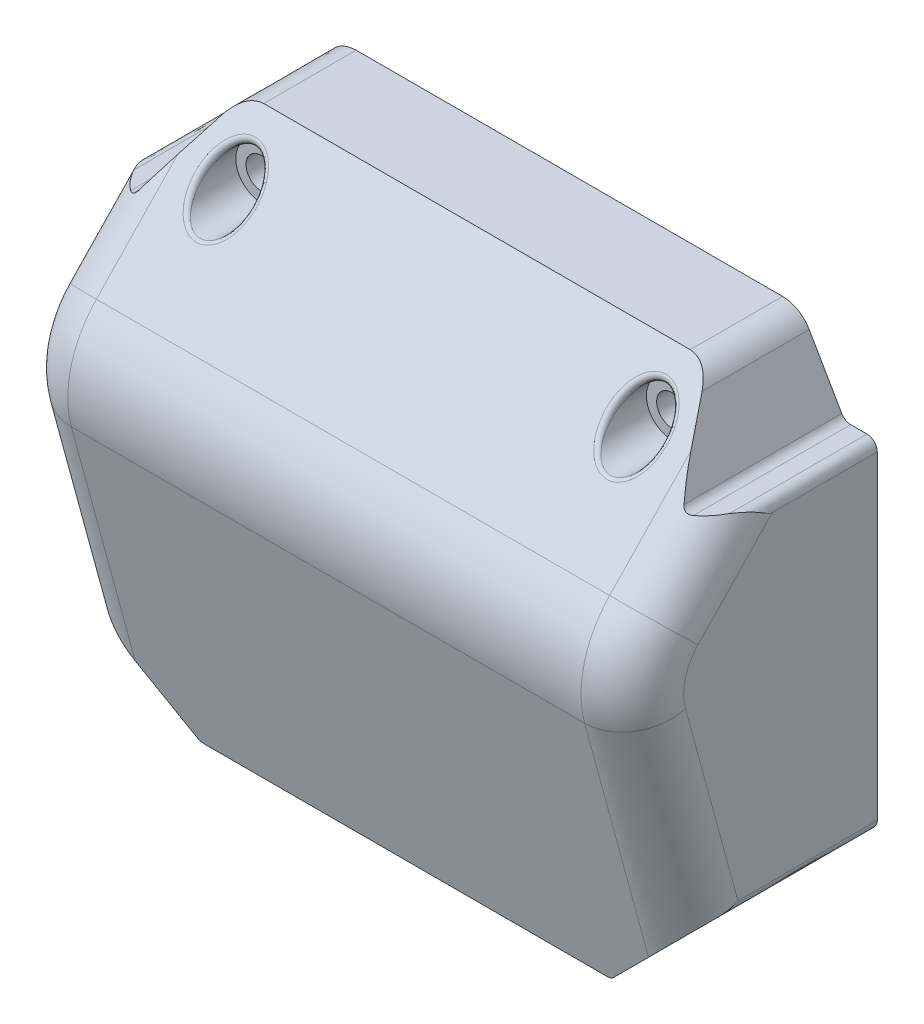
SolidWorks part; units mm, degrees
ref_plane "Płaszczyzna przednia" through (0, 0, 0) normal (0, 0, 1) x (1, 0, 0)
ref_plane "Płaszczyzna górna" through (0, 0, 0) normal (0, 1, 0) x (1, 0, 0)
ref_plane "Płaszczyzna prawa" through (0, 0, 0) normal (1, 0, 0) x (0, 0, -1)
sketch "Szkic1" plane through (0, 0, 0) normal (0, 0, 1) x (1, 0, 0)
  line L0 (-120, 129.8332) -> (-120, 67.6616)
  line L1 (-118, 131.8332) -> (-114.815, 131.8332)
  line L2 (-113.0829, 132.8332) -> (-106.7321, 143.8332)
  line L3 (-101.5359, 146.8332) -> (-18.4641, 146.8332)
  line L5 (-119.4142, 66.2474) -> (-100.5858, 47.419)
  line L6 (-99.1716, 46.8332) -> (-20.8284, 46.8332)
  line L8 (-60, 46.8332) -> (-60, 66.2474) construction
  line L10 (-0.5858, 66.2474) -> (-19.4142, 47.419)
  line L11 (-6.9171, 132.8332) -> (-13.2679, 143.8332)
  line L12 (-2, 131.8332) -> (-5.185, 131.8332)
  line L13 (0, 129.8332) -> (0, 67.6616)
  spline S0 degree 2 poles (-101.5359, 146.8332) (-104.9378, 146.7255) (-106.7321, 143.8332) knots 0 0 0 1 1 1
  spline S1 degree 2 poles (-113.0829, 132.8332) (-113.681, 131.8691) (-114.815, 131.8332) knots 0 0 0 1 1 1
  spline S2 degree 2 poles (-118, 131.8332) (-119.8284, 131.6616) (-120, 129.8332) knots 0 0 0 1 1 1
  spline S3 degree 2 poles (-120, 67.6616) (-119.9884, 66.838) (-119.4142, 66.2474) knots 0 0 0 1 1 1
  spline S4 degree 2 poles (-100.5858, 47.419) (-99.9952, 46.8448) (-99.1716, 46.8332) knots 0 0 0 1 1 1
  spline S5 degree 2 poles (-19.4142, 47.419) (-20.0048, 46.8448) (-20.8284, 46.8332) knots 0 0 0 1 1 1
  spline S6 degree 2 poles (0, 67.6616) (-0.0116, 66.838) (-0.5858, 66.2474) knots 0 0 0 1 1 1
  spline S7 degree 2 poles (-2, 131.8332) (-0.1716, 131.6616) (0, 129.8332) knots 0 0 0 1 1 1
  spline S8 degree 2 poles (-6.9171, 132.8332) (-6.319, 131.8691) (-5.185, 131.8332) knots 0 0 0 1 1 1
  spline S9 degree 2 poles (-18.4641, 146.8332) (-15.0622, 146.7255) (-13.2679, 143.8332) knots 0 0 0 1 1 1
  point P51 (-60, 146.8332)
extrude "Dodanie-wyciągnięcie1" add sketch "Szkic1" along normal blind 50
sketch "Szkic3" plane through (0, 0, 0) normal (1, 0, 0) x (0, 0, -1)
  line L0 (-50, 113.4918) -> (-31.8525, 46.8332)
  line L1 (-50, 67.6616) -> (-50, 129.8332) construction
  line L2 (-50, 46.8332) -> (0, 46.8332) construction
  line L3 (-31.8525, 46.8332) -> (-50, 46.8332)
  line L4 (-50, 46.8332) -> (-50, 113.4918)
  line L5 (-50, 113.4918) -> (-17.9919, 146.8332)
  line L6 (-50, 146.8332) -> (0, 146.8332) construction
  line L7 (-17.9919, 146.8332) -> (-50, 146.8332)
  line L8 (-50, 146.8332) -> (-50, 113.4918)
extrude "Wytnij-wyciągnięcie1" cut sketch "Szkic3" against normal up to next contours L7 L8 L5 M2 | L5 M3 M2 | L0 M3 M4 | L4 L3 L0 M4
fillet "Zaokrąglenie1" radius 20 1 edges at (-60, 113.4918, 50)
ref_plane "Płaszczyzna1" through (0, 0, 50) normal (0, 0, 1) x (1, 0, 0)
sketch "Szkic6" plane through (0, 0, 50) normal (0, 0, 1) x (1, 0, 0)
  line L0 (-101.5359, 146.8332) -> (-18.4641, 146.8332) construction
  line L1 (-120, 129.8332) -> (-120, 121.6646) construction
  circle A0 centre (-100, 136.8332) radius 3
  dimension "D1" = 10
  dimension "D2" = 20
extrude "Wytnij-wyciągnięcie2" cut sketch "Szkic6" against normal through all
ref_plane "Płaszczyzna2" through (-60, 0, 0) normal (1, 0, 0) x (0, 0, -1)
ref_plane "Płaszczyzna3" through (0, 100, 0) normal (0, 1, 0) x (1, 0, 0)
sketch "Szkic7" plane through (0, 0, 50) normal (0, 0, 1) x (1, 0, 0)
  circle A0 centre (-100, 136.8332) radius 5
extrude "Wytnij-wyciągnięcie3" cut sketch "Szkic7" against normal blind 30
fillet "Zaokrąglenie2" radius 1 1 edges at (-100, 131.8332, 32.3921)
mirror "Lustro1" about plane through (-60, 0, 0) normal (1, 0, 0) of "Wytnij-wyciągnięcie3", "Wytnij-wyciągnięcie2", "Zaokrąglenie2"
sketch "Szkic8" plane through (0, 0, 0) normal (0, 0, -1) x (-1, 0, 0)
  line L0 (0.5858, 131.2474) -> (119.8478, 66.8963) construction
  line L2 (45.2168, 114.0719) -> (75.2168, 114.0719)
  line L3 (45.2168, 114.0719) -> (45.2168, 84.0719)
  line L4 (45.2168, 84.0719) -> (75.2168, 84.0719)
  line L5 (75.2168, 114.0719) -> (75.2168, 84.0719)
  line L6 (45.2168, 114.0719) -> (75.2168, 84.0719) construction
  line L7 (45.2168, 84.0719) -> (75.2168, 114.0719) construction
  parabola Q0 construction
  parabola Q1 construction
  point P10 (60.2168, 99.0719)
  dimension "D1" = 30
  dimension "D2" = 30
extrude "Wytnij-wyciągnięcie4" cut sketch "Szkic8" against normal blind 10
fillet "Zaokrąglenie3" radius 10 3 edges at (0, 112.7542, 47.1065)
fillet "Zaokrąglenie4" radius 10 3 edges at (-120, 112.7542, 47.1065)
